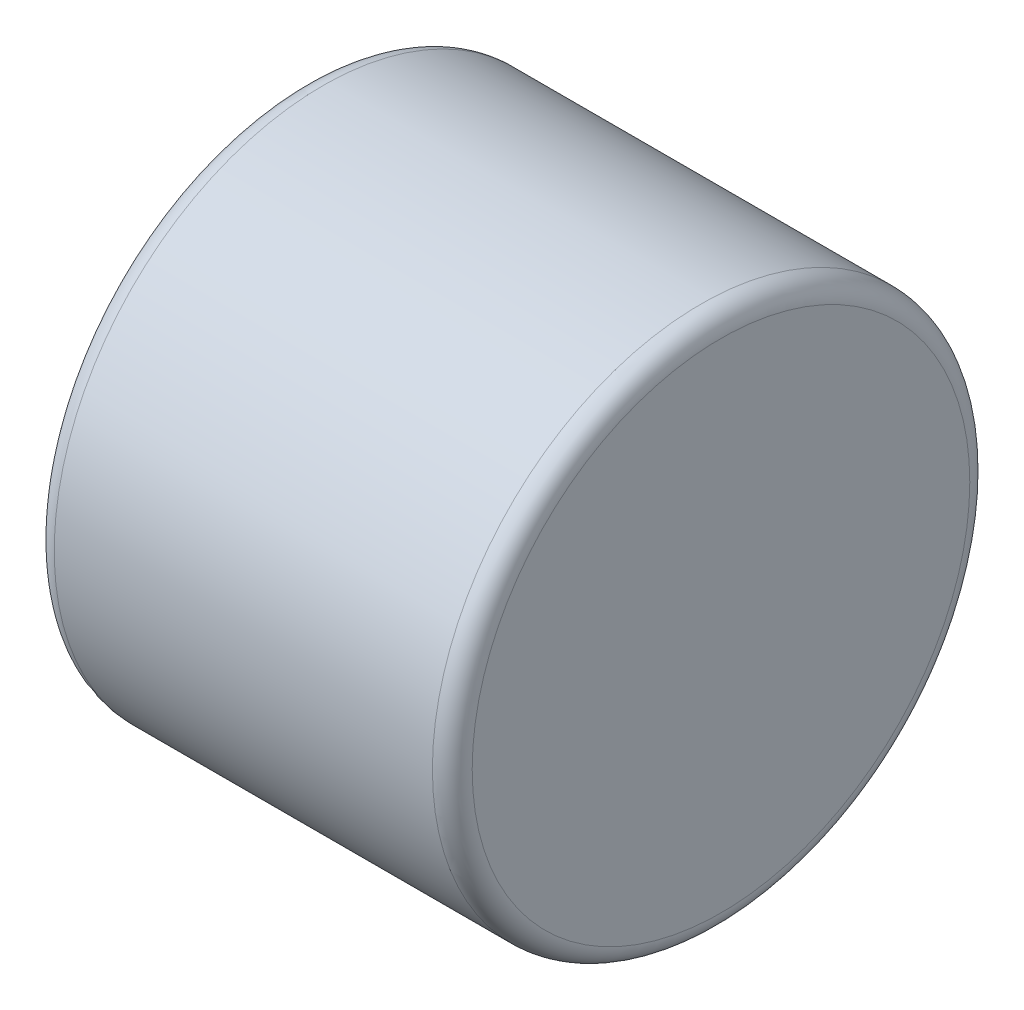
SolidWorks part; units mm, degrees
ref_plane "Plane1" through (0, 0, 0) normal (0, 0, 1) x (1, 0, 0)
ref_plane "Plane2" through (0, 0, 0) normal (0, 1, 0) x (1, 0, 0)
ref_plane "Plane3" through (0, 0, 0) normal (1, 0, 0) x (0, 0, -1)
sketch "Esquisse1" plane through (0, 0, 0) normal (0, 0, 1) x (1, 0, 0)
  line L0 (-2.1, 0) -> (2.1, 0)
  line L1 (-2.1, 0) -> (-2.1, 2.7)
  line L2 (2.1, 2.7) -> (-2.1, 2.7)
  line L3 (2.1, 2.7) -> (2.1, 0)
  line L4 (3.2, 0) -> (-3.3, 0) construction
  dimension "D1" = 2.7
revolve "Base-Révolution" add sketch "Esquisse1" angle 360 about L4
fillet "Congé1" radius 0.2
